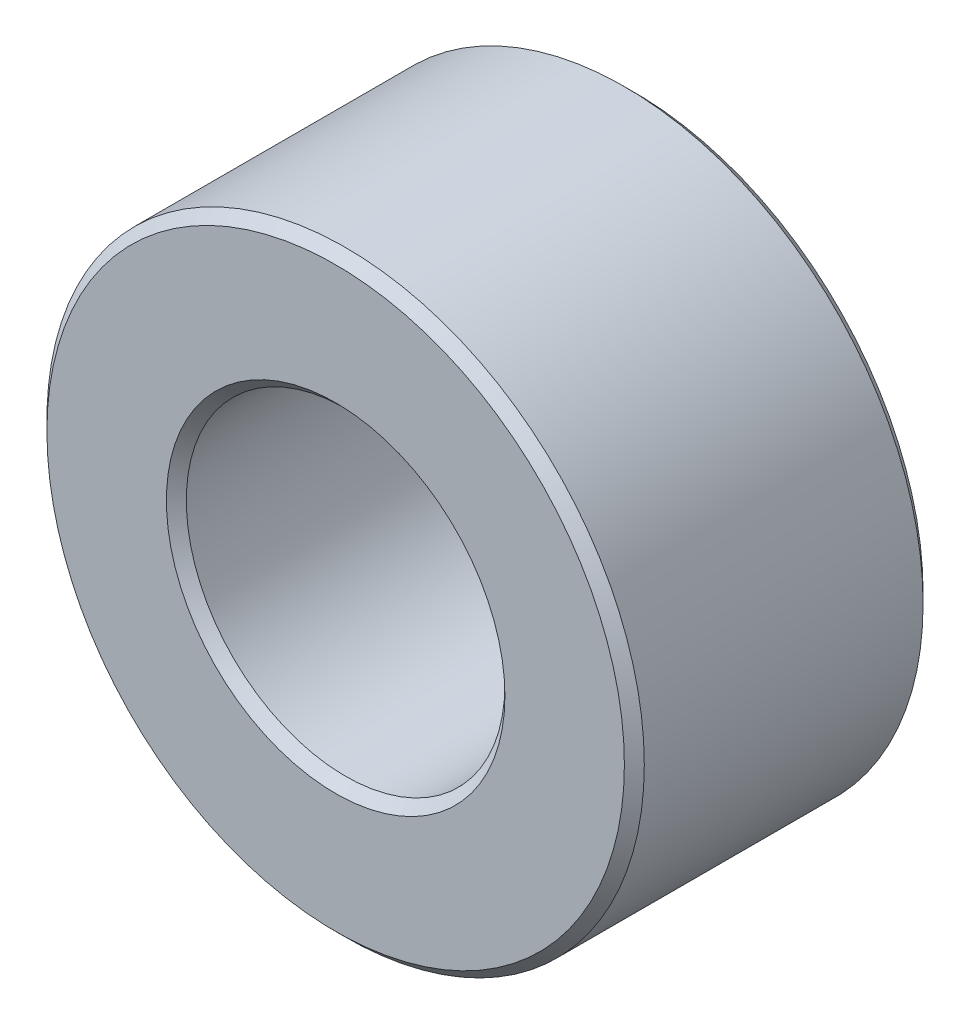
SolidWorks part; units mm, degrees
ref_plane "Front Plane" through (0, 0, 0) normal (0, 0, 1) x (1, 0, 0)
ref_plane "Top Plane" through (0, 0, 0) normal (0, 1, 0) x (1, 0, 0)
ref_plane "Right Plane" through (0, 0, 0) normal (1, 0, 0) x (0, 0, -1)
sketch "Sketch1" plane through (0, 0, 0) normal (0, 0, 1) x (1, 0, 0)
  circle A0 centre (0, 0) radius 3
  circle A1 centre (0, 0) radius 1.6
  dimension "D1" = 6
  dimension "D2" = 3.2
extrude "Boss-Extrude2" add sketch "Sketch1" along normal mid plane 3
chamfer "Chamfer3" distance 0.1 angle 45 4 edges at (3, 0, 1.5) (3, 0, -1.5) (1.6, 0, -1.5) (1.6, 0, 1.5)
